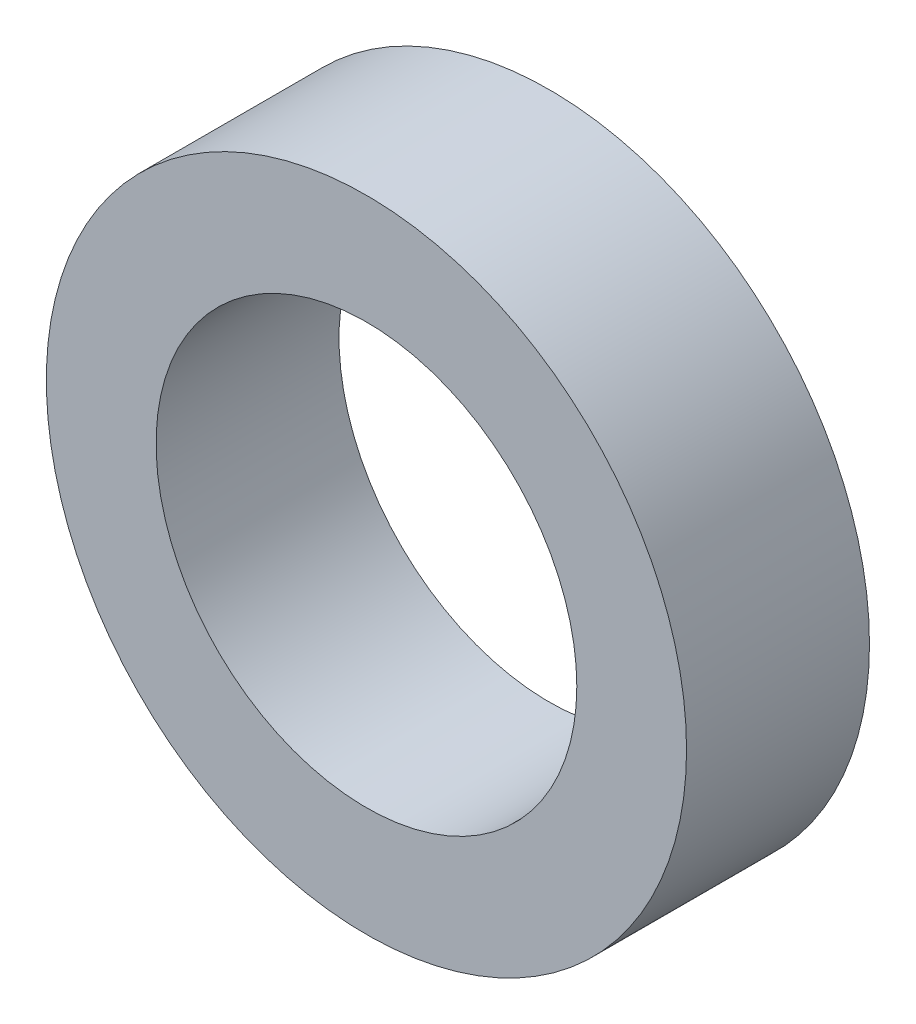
SolidWorks part; units mm, degrees
ref_plane "Plane1" through (0, 0, 0) normal (0, 0, 1) x (1, 0, 0)
ref_plane "Plane2" through (0, 0, 0) normal (0, 1, 0) x (1, 0, 0)
ref_plane "Plane3" through (0, 0, 0) normal (1, 0, 0) x (0, 0, -1)
other "Configuration Table"
sketch "Sketch1" plane through (0, 0, 0) normal (0, 0, 1) x (1, 0, 0)
  circle A0 centre (0, 0) radius 29.21
  circle A1 centre (0, 0) radius 44.45
extrude "BasePipeXXS" add sketch "Sketch1" along normal mid plane 25.4
